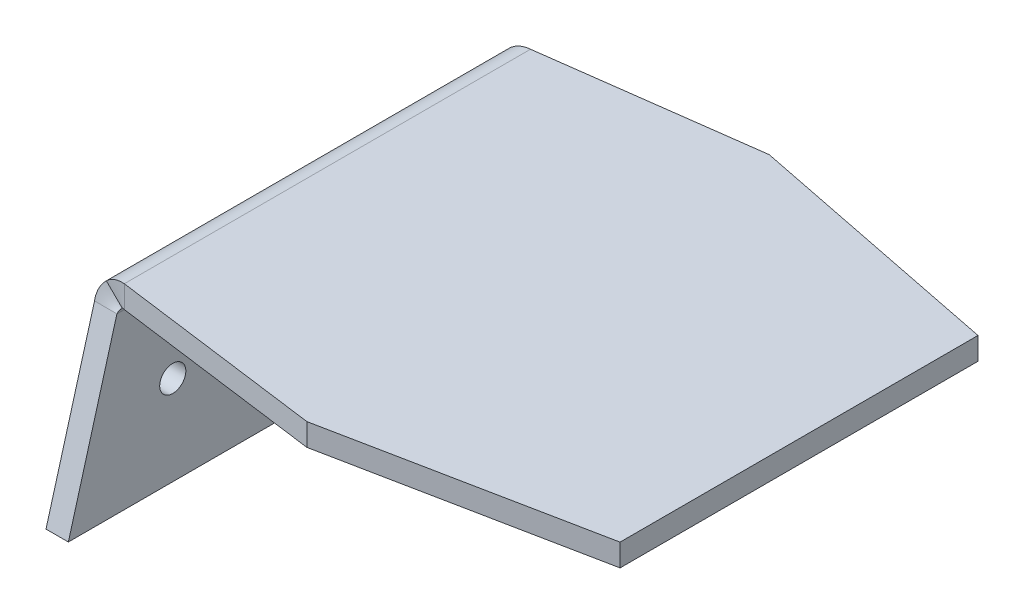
SolidWorks part; units mm, degrees
ref_plane "Front Plane" through (0, 0, 0) normal (0, 0, 1) x (1, 0, 0)
ref_plane "Top Plane" through (0, 0, 0) normal (0, 1, 0) x (1, 0, 0)
ref_plane "Right Plane" through (0, 0, 0) normal (1, 0, 0) x (0, 0, -1)
sketch "Sketch1" plane through (0, 0, 0) normal (0, 1, 0) x (1, 0, 0)
  line L0 (0, 0) -> (90, 0) construction
  line L1 (0, -34) -> (0, 34)
  line L2 (0, 34) -> (25, 27)
  line L3 (25, 27) -> (55, 31)
  line L4 (55, 31) -> (90, 24)
  line L5 (90, 24) -> (90, -24)
  line L6 (12, 30.64) -> (12, 0) construction
  line L7 (0, -34) -> (25, -27)
  line L8 (25, -27) -> (55, -31)
  line L9 (55, -31) -> (90, -24)
  circle A0 centre (12, 20) radius 1.75
  circle A1 centre (12, -20) radius 1.75
  dimension "D8" = 20
  dimension "D9" = 3.5
  dimension "D1" = 34
  dimension "D2" = 27
  dimension "D3" = 31
  dimension "D4" = 24
  dimension "D5" = 35
  dimension "D6" = 30
  dimension "D7" = 25
  dimension "D10" = 12
sheet metal parameters "Sheet-Metal1" thickness 3 parameters "D1"=0.7366
base flange "Base-Flange1" sketch "Sketch1" thickness 3 reverse thickness direction yes parameters "D1"=0.7366
sketch "Sketch3" plane through (0, 3, 0) normal (0, 1, 0) x (1, 0, 0)
  line L0 (25, 27) -> (25, -27)
sketched bend "Sketched Bend1" parameters "D1"=0.7366
bend "SketchBend1" bend radius 0.7366 bend angle 90 parameters "D5"=1
flat pattern "Flat-Pattern1"
sketch "Bend-Lines1" plane through (0, 0, 0) normal (0, 1, 0) x (-1, 0, 0)
bend of the flat pattern "Flatten-<SketchBend1>1"
